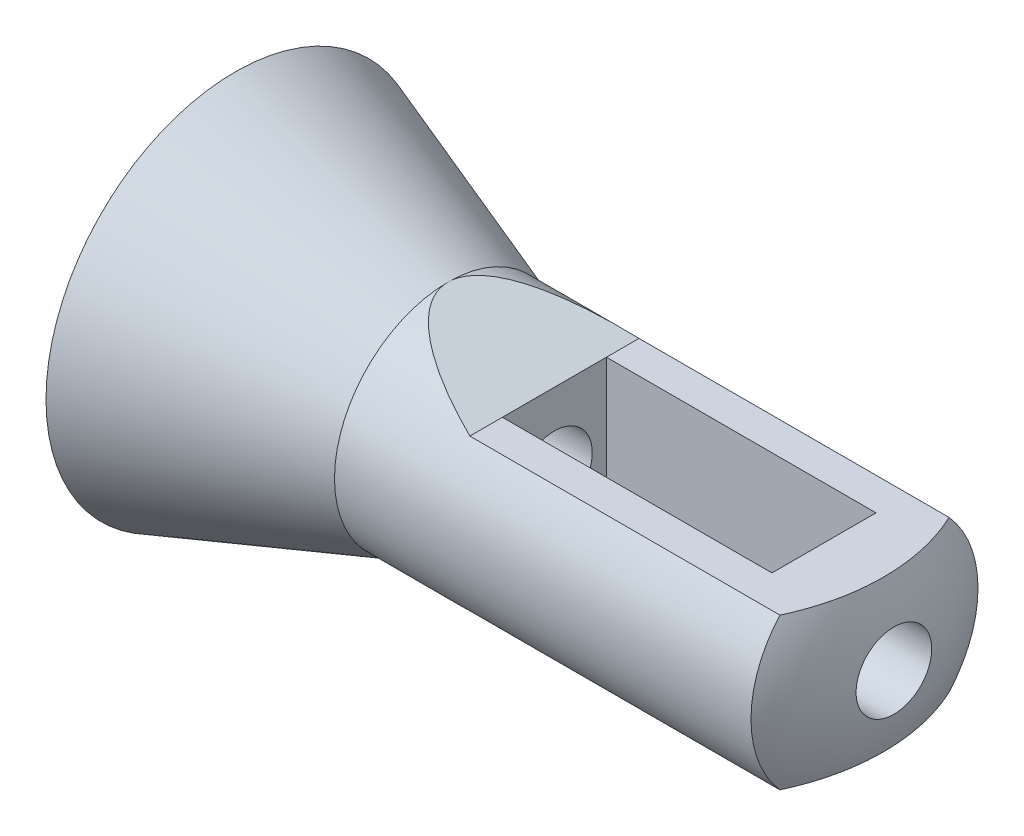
SolidWorks part; units mm, degrees
ref_plane "Front Plane" through (0, 0, 0) normal (0, 0, 1) x (1, 0, 0)
ref_plane "Top Plane" through (0, 0, 0) normal (0, 1, 0) x (1, 0, 0)
ref_plane "Right Plane" through (0, 0, 0) normal (1, 0, 0) x (0, 0, -1)
sketch "Sketch1" plane through (0, 0, 0) normal (0, 1, 0) x (1, 0, 0)
  line L0 (0, 0) -> (0, 40)
  line L1 (0, 40) -> (45, 24)
  line L2 (45, 24) -> (133.0657, 24)
  line L3 (0, 0) -> (140, 0) construction
  line L4 (0, 0) -> (140, 0)
  arc A0 (133.0657, 24) -> (140, 0) centre (95, 0) cw
  dimension "D5" = 45
  dimension "D1" = 140
  dimension "D2" = 45
  dimension "D3" = 48
  dimension "D4" = 80
revolve "Revolve1" add sketch "Sketch1" angle 360 about L3
sketch "Sketch2" plane through (0, 0, 0) normal (0, 0, 1) x (1, 0, 0)
  line L0 (45, 24) -> (0, 40) construction
  line L1 (67.5, 16) -> (0, 40)
  line L2 (67.5, 16) -> (137.0595, 16)
  line L3 (0, 0) -> (158.3091, 0) construction
  arc A0 (133.0657, -24) -> (133.0657, 24) centre (95, 0) ccw construction
  dimension "D1" = 32
extrude "Cut-Extrude1" cut sketch "Sketch2" against normal through all and the other way through all
mirror "Mirror1" about plane through (0, 0, 0) normal (0, 1, 0) of "Cut-Extrude1"
sketch "Sketch3" plane through (0, 0, 0) normal (0, 1, 0) x (1, 0, 0)
  line L0 (0, 0) -> (140, 0) construction
  line L1 (0, 23.0187) -> (0, 0)
  line L3 (42.2402, 8) -> (140, 8)
  line L4 (0, 40) -> (0, -40) construction
  line L5 (133.0657, 24) -> (45, 24) construction
  line L6 (39.6398, 8.9246) -> (-5.3602, 24.9246)
  line L7 (42.2402, 8) -> (0, 23.0187)
  line L11 (140, 0) -> (140, 8)
  line L12 (0, 0) -> (140, 0)
  arc A5 (133.0657, -24) -> (133.0657, 24) centre (95, 0) ccw construction
  dimension "D1" = 16
  dimension "D2" = 16
revolve "Cut-Revolve2" cut sketch "Sketch3" angle 360 about L0
sketch "Sketch4" plane through (0, 16, 0) normal (0, 1, 0) x (1, 0, 0)
  line L0 (0, 0) -> (144.6355, 0) construction
  line L1 (67.5, -17.8885) -> (67.5, 17.8885) construction
  line L2 (67.5, 11) -> (124.5, 11)
  line L3 (67.5, 11) -> (67.5, -11)
  line L4 (67.5, -11) -> (124.5, -11)
  line L5 (124.5, 11) -> (124.5, -11)
  dimension "D1" = 57
  dimension "D2" = 22
extrude "Cut-Extrude2" cut sketch "Sketch4" against normal through all
